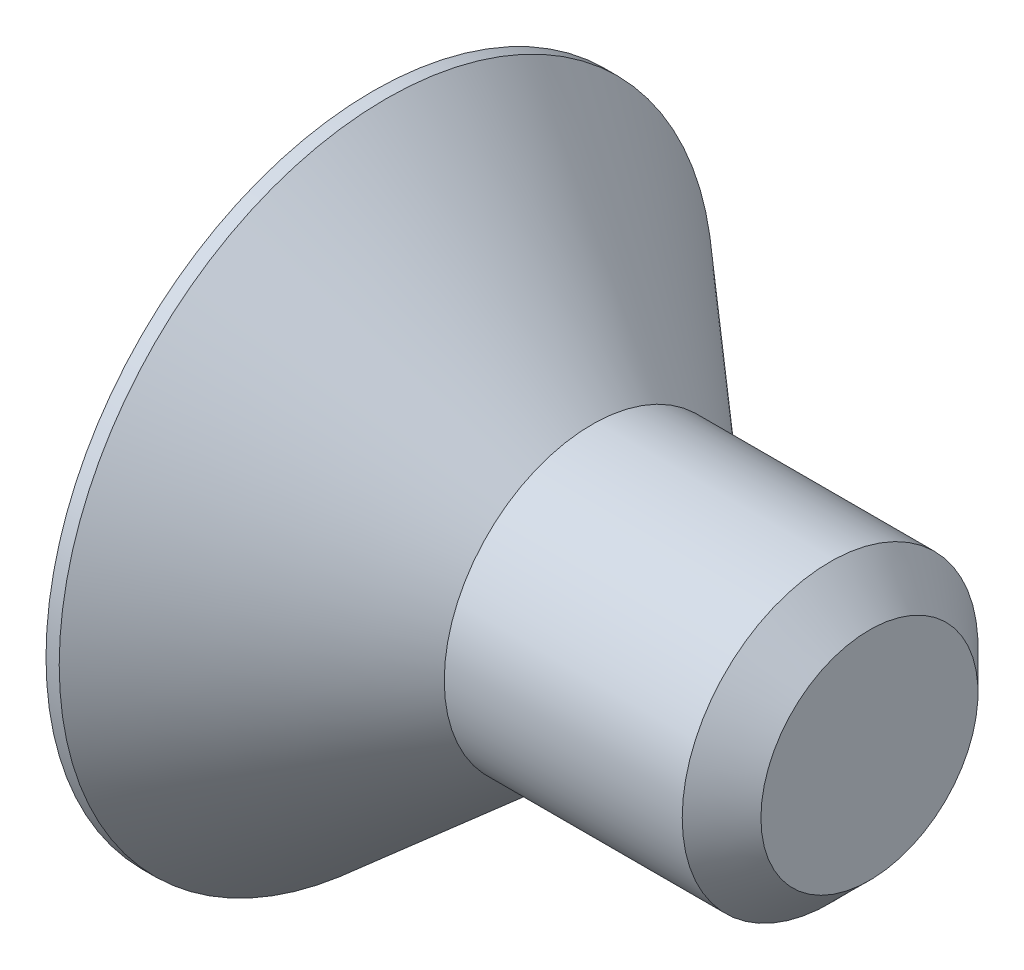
SolidWorks part; units mm, degrees
revolve "PreBroach" cut sketch "Sketch2"
sketch "Sketch2"
  line L0 (0, 0.7937) -> (1.397, 0.7937)
  line L1 (1.397, 0.7937) -> (1.8553, 0)
  line L2 (0, 0) -> (127, 0) construction
  line L3 (1.8553, 0) -> (0, 0)
  line L4 (0, 0) -> (0, 0.7937)
  line L5 (0, -0.7937) -> (1.397, -0.7937) construction
  line L6 (0, 0) -> (47.625, 0) construction
  line L8 (0, 3.1445) -> (0, -3.1445) construction
revolve "BaseBody" add sketch "BodySke" angle 360 about L6
sketch "BodySke" plane through (0, 0, 0) normal (0, 0, 1) x (1, 0, 0)
  line L0 (0, 0) -> (0, 3.1445)
  line L1 (0.127, 3.1445) -> (2.1081, 1.4224)
  line L2 (0, 3.1445) -> (0.127, 3.1445)
  line L3 (2.1081, 1.4224) -> (4.3967, 1.4224)
  line L4 (4.7752, 1.0439) -> (4.7752, 0)
  line L5 (4.7752, 0) -> (0, 0)
  line L6 (0, 0) -> (127, 0) construction
  line L7 (0.127, -3.1445) -> (2.1081, -1.4224) construction
  line L8 (4.7752, 1.0439) -> (4.3967, 1.4224)
  line L9 (0, -3.1445) -> (0.127, -3.1445) construction
  line L10 (4.7752, -1.0439) -> (4.3967, -1.4224) construction
  line L11 (2.7431, 7.7724) -> (2.7431, -14.4526) construction
  line L12 (0, 19.05) -> (0, -3.175) construction
ref_plane "Plane1" through (0, 0, 0) normal (0, 0, 1) x (1, 0, 0)
ref_plane "Plane2" through (0, 0, 0) normal (0, 1, 0) x (1, 0, 0)
ref_plane "Plane3" through (0, 0, 0) normal (1, 0, 0) x (0, 0, -1)
sketch "Sketch3" plane through (0, 0, 0) normal (-1, 0, 0) x (0, 0, 1)
  line L0 (-0.7937, -0.4583) -> (-0.7937, 0.4583)
  line L1 (-0.7937, 0.4583) -> (0, 0.9165)
  line L2 (0, 0.9165) -> (0.7937, 0.4583)
  line L3 (0.7937, 0.4583) -> (0.7937, -0.4583)
  line L4 (0.7937, -0.4583) -> (0, -0.9165)
  line L5 (0, -0.9165) -> (-0.7937, -0.4583)
extrude "Hex" cut sketch "Sketch3" against normal blind 1.397
sketch "Sketch4" plane through (0, 0, 0) normal (-1, 0, 0) x (0, 0, 1)
  line L0 (0, 0) -> (0.9398, 0)
  line L1 (0, 0) -> (6.1484, 3.5498) construction
  line L2 (0, 0) -> (0.4699, 0.8139)
  line L3 (0.7832, 0.2175) -> (0.8962, 0.2828)
  line L4 (0.58, 0.5695) -> (0.693, 0.6348)
  arc A0 (0.7832, 0.2175) -> (0.58, 0.5695) centre (0, 0) ccw
  arc A1 (0.9398, 0) -> (0.8962, 0.2828) centre (0, 0) ccw
  arc A2 (0.4699, 0.8139) -> (0.693, 0.6348) centre (0, 0) cw
extrude "Spline" [suppressed] cut sketch "Sketch4" against normal blind 1.397
pattern_circular "CirPattern1" [suppressed] count 6 every 60 about axis through (0, 0, 0) along (1, 0, 0)
sketch "ThdSchSke" plane through (0, 0, 0) normal (0, 0, 1) x (1, 0, 0)
  line L0 (2.6161, -1.0439) -> (2.3511, -1.4224)
  line L1 (2.6161, -1.0439) -> (2.8811, -1.4224)
  line L2 (2.8811, -1.4224) -> (2.8811, -1.778)
  line L3 (-3.175, 0) -> (5.1513, 0) construction
  line L4 (0, 3.1445) -> (0, -3.1445) construction
  line L5 (2.8811, -1.778) -> (2.3511, -1.778)
  line L6 (2.3511, -1.778) -> (2.3511, -1.4224)
revolve "ThreadSchematic" [suppressed] cut sketch "ThdSchSke" angle 360 about L3
pattern_linear "ThdSchPat" [suppressed]
equation "\"D3@Sketch4\" = \"Spline_p_dim@Sketch4\" / 2"
equation "\"Thread_minor@ThreadCosmetic\"  =  \"Minor_dia@BodySke\""
equation "\"D2@CirPattern1\" = 360 / \"Num_teeth@CirPattern1\""
equation "\"D1@Sketch3\" = \"Hex_size@Sketch3\" / 2"
equation "\"D2@Sketch3\" = \"D1@Sketch3\""
equation "\"D3@Sketch3\" = \"Hex_size@Sketch3\""
equation "\"Thread_length@ThreadCosmetic\" = ((sgn( (\"Length@BodySke\" - \"Advance@BodySke\" - ( ( ( \"Head_dia@BodySke\" - \"Diameter@BodySke\" ) * 0.5 ) / tan( \"Head_ang@BodySke\" * 0.008726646 ) ) ) - \"Thread_nom@Body"
equation "\"Thread_minor@ThdSchSke\" = \"Minor_dia@BodySke\""
equation "\"Diameter@ThdSchSke\" = \"Diameter@BodySke\""
equation "\"Overcut@ThdSchSke\" = \"Diameter@BodySke\" * 1.25"
equation "\"Start@ThdSchSke\" = 0.000001 + \"Length@BodySke\" - \"Thread_length@ThreadCosmetic\"  '---Countersunk---"
equation "\"Num_threads@ThdSchPat\" = int( \"Thread_length@ThreadCosmetic\" / \"Advance@BodySke\" + 0.999 )  + 1"
equation "\"Advance@ThdSchPat\" = \"Thread_length@ThreadCosmetic\" /  (\"Num_threads@ThdSchPat\" - 1) 'relax it"
equation "\"Num_threads@ThdSchPat\" = \"Num_threads@ThdSchPat\" - sgn( \"Num_threads@ThdSchPat\" - 1) '---chamfered tips only---"
